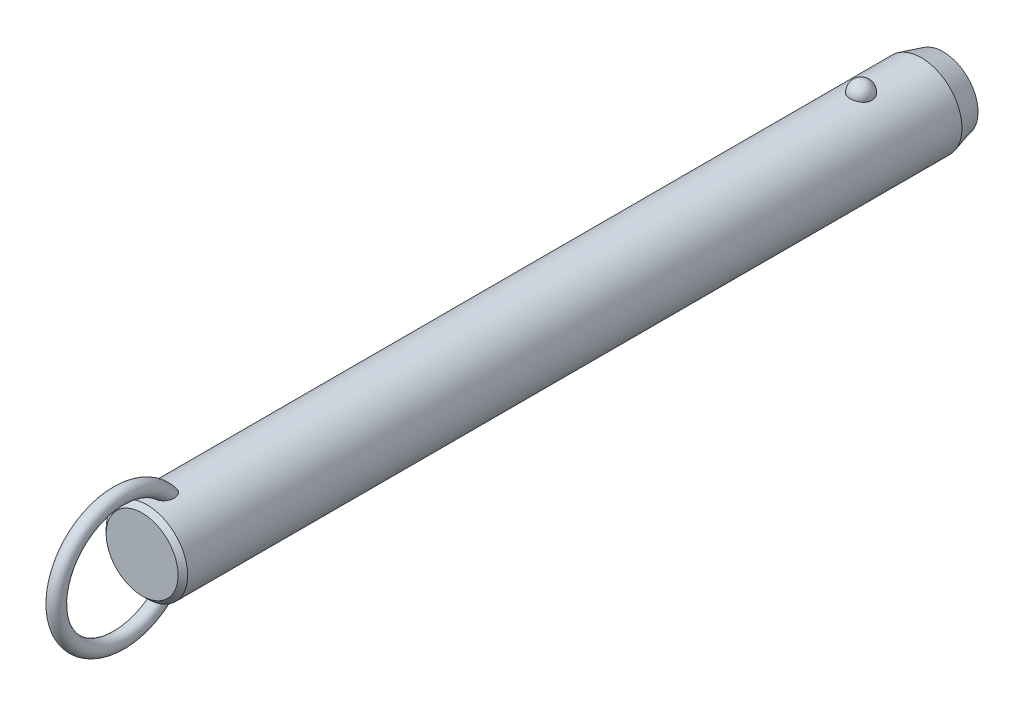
SolidWorks part; units mm, degrees
ref_plane "Front Plane" through (0, 0, 0) normal (0, 0, 1) x (1, 0, 0)
ref_plane "Top Plane" through (0, 0, 0) normal (0, 1, 0) x (1, 0, 0)
ref_plane "Right Plane" through (0, 0, 0) normal (1, 0, 0) x (0, 0, -1)
sketch "Sketch2" plane through (0, 0, 0) normal (0, 0, 1) x (1, 0, 0)
  circle A0 centre (0, 0) radius 11.1
  point P3 (0, 11.1)
  dimension "D1" = 22.2
extrude "Boss-Extrude1" add sketch "Sketch2" along normal blind 180.3
sketch "Sketch3" plane through (0, 0, 0) normal (0, 0, -1) x (-1, 0, 0)
  circle A0 centre (0, 0) radius 11.1
  dimension "D1" = 22.2
extrude "Boss-Extrude2" add sketch "Sketch3" along normal blind 25.4
chamfer "Chamfer1" distance 6 angle 15 1 edges at (-11.1, 0, -25.4)
sketch "Sketch12" plane through (0, 0, 0) normal (1, 0, 0) x (0, 0, -1)
  line L0 (-180.3, 11.1) -> (-180.3, -11.1) construction
  point P0 (-180.3, 0)
sketch "Sketch13" plane through (0, 0, 0) normal (1, 0, 0) x (0, 0, -1)
  circle A0 centre (-199.35, 0) radius 19.05
  point P2 (-180.3, 0)
  dimension "D1" = 38.1
sketch "Sketch14" plane through (0, 0, 0) normal (0, 1, 0) x (1, 0, 0)
  circle A0 centre (0, -182.3) radius 2
  point P2 (0, -180.3)
  dimension "D1" = 4
sweep "Sweep1" add profiles "Sketch14" path "Sketch13"
sketch "Sketch15" plane through (0, 0, 180.3) normal (0, 0, 1) x (1, 0, 0)
  circle A0 centre (0, 0) radius 11.1
  dimension "D1" = 22.2
extrude "Boss-Extrude3" add sketch "Sketch15" along normal blind 12.7
chamfer "Chamfer2" distance 1.3 angle 45 1 edges at (11.1, 0, 193)
sketch "Sketch18" plane through (0, 0, 0) normal (1, 0, 0) x (0, 0, -1)
  line L0 (19.4, 11.1) -> (-183.868, 11.1) construction
  line L1 (3, 14.1) -> (3, 8.1)
  line L2 (-183.868, -11.1) -> (19.4, -11.1) construction
  arc A0 (3, 14.1) -> (3, 8.1) centre (3, 11.1) ccw
  point P4 (0, 11.1)
  dimension "D1" = 25.2
revolve "Revolve1" add sketch "Sketch18" angle 360 about L1
